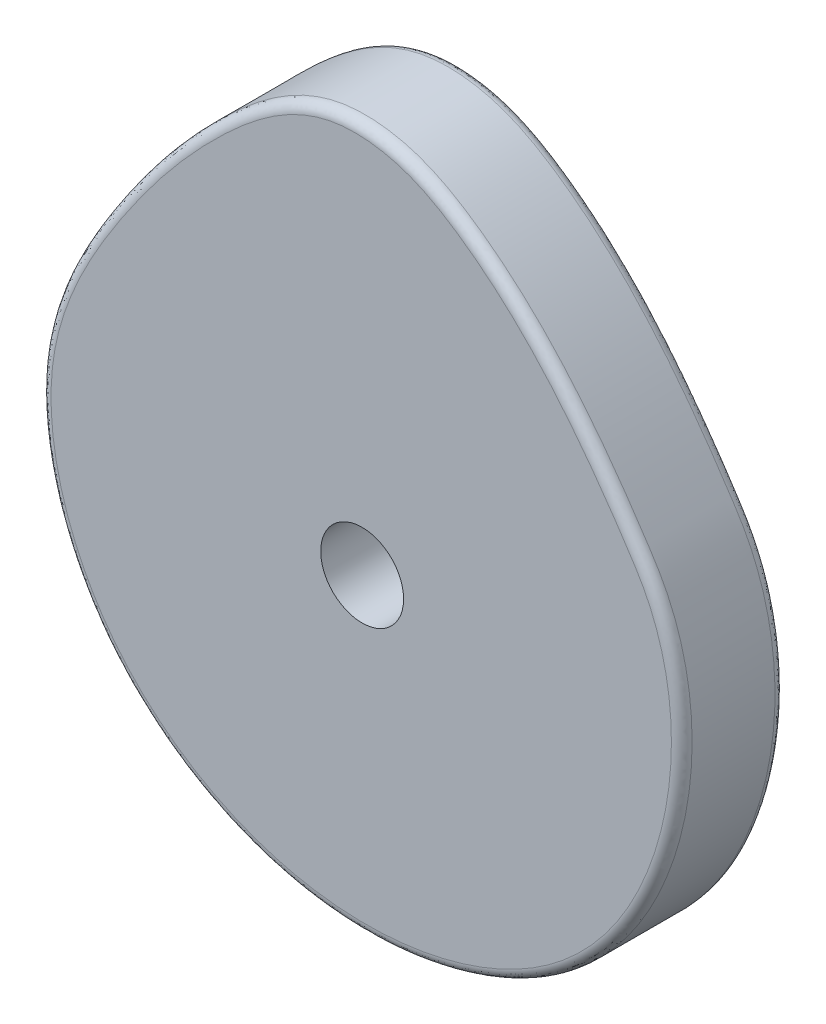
SolidWorks part; units mm, degrees
ref_plane "Front Plane" through (0, 0, 0) normal (0, 0, 1) x (1, 0, 0)
ref_plane "Top Plane" through (0, 0, 0) normal (0, 1, 0) x (1, 0, 0)
ref_plane "Right Plane" through (0, 0, 0) normal (1, 0, 0) x (0, 0, -1)
sketch "Sketch2" plane through (0, 0, 0) normal (0, 0, 1) x (1, 0, 0)
  circle A1 centre (0, 0) radius 4
  spline S1 degree 3 poles (-33.5305, 2.1887) (-24.6552, 18.737) (-15.5271, 30.258) (-5.2286, 38.3465) (4.206, 37.3927) (15.4633, 30.8329) (22.553, 21.65) (32.8504, 5.6657) (30.7743, -12.528) (15.7294, -28.3595) (-5.5341, -32.5652) (-27.1722, -20.0513) (-33.5305, 2.1887) (-24.6552, 18.737) (-15.5271, 30.258) knots -0.313509 -0.193573 -0.082416 0 0.081511 0.14678 0.186019 0.217894 0.344143 0.357019 0.50853 0.567531 0.686491 0.806427 0.917584 1 1.081511 1.14678 1.186019 only from (-24.3127, 18.3817) to (-24.3127, 18.3817)
extrude "Boss-Extrude1" add sketch "Sketch2" along normal blind 10
fillet "Fillet1" radius 1 2 edges
